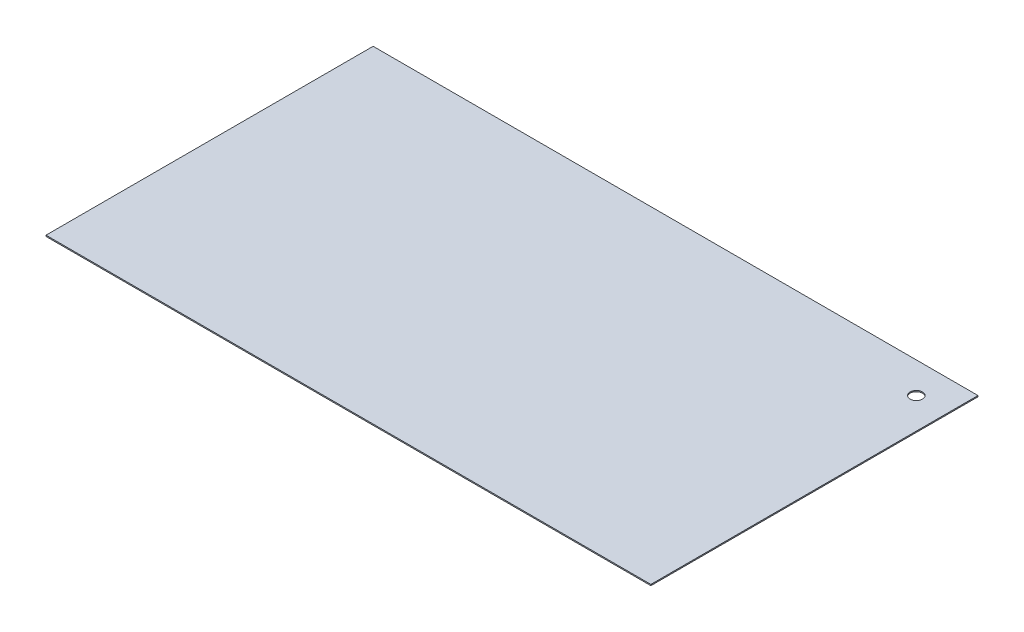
SolidWorks part; units mm, degrees
ref_plane "Front Plane" through (0, 0, 0) normal (0, 0, 1) x (1, 0, 0)
ref_plane "Top Plane" through (0, 0, 0) normal (0, 1, 0) x (1, 0, 0)
ref_plane "Right Plane" through (0, 0, 0) normal (1, 0, 0) x (0, 0, -1)
sketch "Sketch1" plane through (0, 0, 0) normal (0, 1, 0) x (1, 0, 0)
  line L1 (0, 0) -> (4978.4, 0)
  line L2 (0, 0) -> (0, 2692.4)
  line L3 (0, 2692.4) -> (4978.4, 2692.4)
  line L4 (4978.4, 0) -> (4978.4, 2692.4)
  dimension "D1" = 4978.4
  dimension "D2" = 2692.4
extrude "Extrude1" add sketch "Sketch1" along normal blind 9.525
hole_wizard "4 Clearance Hole1" positions "Sketch3" profile "Sketch2" hole size "4" standard "Ansi Inch"
sketch "Sketch3" plane through (0, 9.525, 0) normal (0, 1, 0) x (-1, 0, 0)
  line L0 (-4978.4, -2692.4) -> (0, -2692.4) construction
  line L1 (-4978.4, 0) -> (-4978.4, -2692.4) construction
  point P0 (-4724.4, -2438.4)
  dimension "D1" = 254
  dimension "D2" = 254
sketch "Sketch2" plane through (4724.4, 9.525, -2438.4) normal (1, 0, 0) x (0, 0, 1)
  line L0 (0, 0) -> (0, 40.2868)
  line L1 (0, 40.2868) -> (51.1962, 9.525)
  line L2 (51.1962, 9.525) -> (51.1962, 0)
  line L5 (51.1962, 0) -> (0, 0)
  line L10 (0, 40.2868) -> (-51.1962, 9.525) construction
  line L11 (0, -6.35) -> (0, 107.95) construction
  dimension "Hole Dia." = 102.3925
  dimension "Hole Depth" = 9.525
  dimension "Drill Angle" = 118
